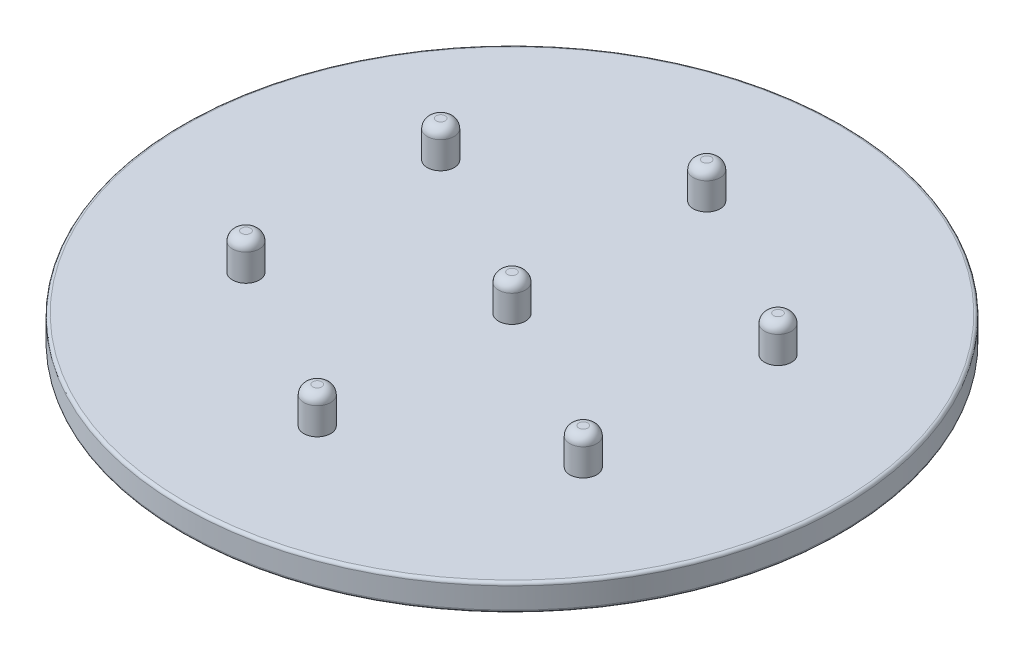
SolidWorks part; units mm, degrees
ref_plane "Front Plane" through (0, 0, 0) normal (0, 0, 1) x (1, 0, 0)
ref_plane "Top Plane" through (0, 0, 0) normal (0, 1, 0) x (1, 0, 0)
ref_plane "Right Plane" through (0, 0, 0) normal (1, 0, 0) x (0, 0, -1)
body saved out of another part "Stock-Cog test-1"
fillet "Fillet1" radius 1 2 edges at (0, -9, 110) (0, 0, 110)
